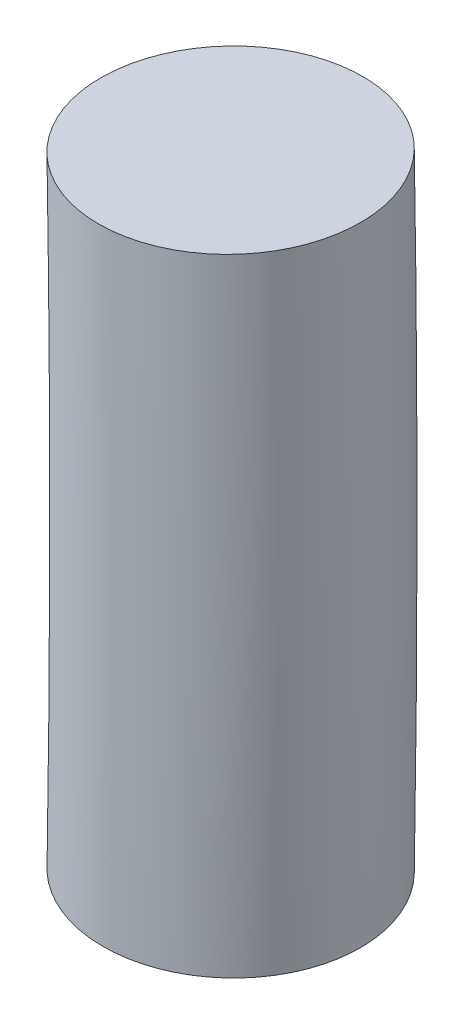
SolidWorks part; units mm, degrees
ref_plane "Front Plane" through (0, 0, 0) normal (0, 0, 1) x (1, 0, 0)
ref_plane "Top Plane" through (0, 0, 0) normal (0, 1, 0) x (1, 0, 0)
ref_plane "Right Plane" through (0, 0, 0) normal (1, 0, 0) x (0, 0, -1)
sketch "Sketch1" plane through (0, 0, 0) normal (0, 1, 0) x (1, 0, 0)
  circle A0 centre (0, 0) radius 7.9375
  point P0 (0, 0)
  dimension "D3" = 15.875
extrude "Block" add sketch "Sketch1" along normal blind 38.1 contours A0
other "Flex1" parameters "D0"=2, "D1"=0, "D2"=0
